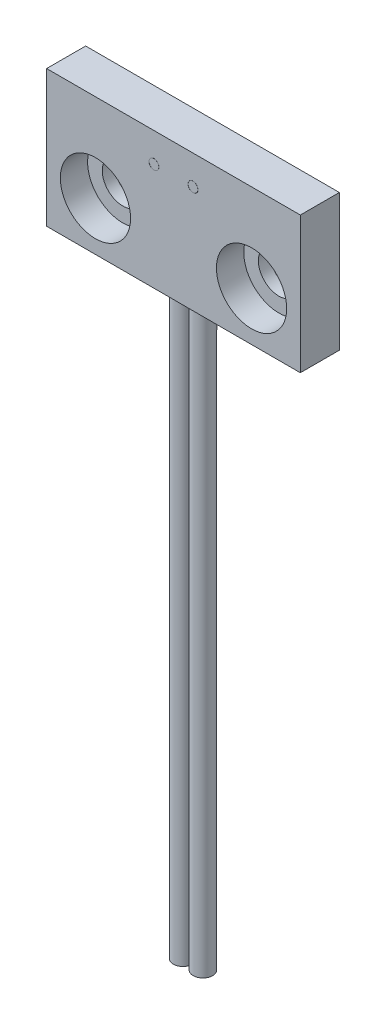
SolidWorks part; units mm, degrees
ref_plane "前视基准面" through (0, 0, 0) normal (0, 0, 1) x (1, 0, 0)
ref_plane "上视基准面" through (0, 0, 0) normal (0, 1, 0) x (1, 0, 0)
ref_plane "右视基准面" through (0, 0, 0) normal (1, 0, 0) x (0, 0, -1)
sketch "草图1" plane through (0, 0, 0) normal (0, 0, 1) x (1, 0, 0)
  line L1 (6.5, -3.5) -> (-6.5, -3.5)
  line L2 (6.5, -3.5) -> (6.5, 3.5)
  line L3 (6.5, 3.5) -> (-6.5, 3.5)
  line L4 (-6.5, -3.5) -> (-6.5, 3.5)
  line L5 (6.5, -3.5) -> (-6.5, 3.5) construction
  line L6 (6.5, 3.5) -> (-6.5, -3.5) construction
  point P0 (0, 0)
  dimension "D1" = 7
  dimension "D2" = 13
extrude "凸台-拉伸1" add sketch "草图1" along normal mid plane 2
hole_wizard "沉头孔1" positions "草图6" profile "草图7" counterbore size "M2" standard "GB"
sketch "草图6" plane through (0, 0, 1) normal (0, 0, 1) x (1, 0, 0)
  line L1 (6.5, 3.5) -> (-6.5, 3.5) construction
  point P0 (-4, -1)
  point P2 (4, -1)
  dimension "D1" = 8
  dimension "D2" = 4
  dimension "D3" = 4.5
sketch "草图7" plane through (-4, -1, 1) normal (1, 0, 0) x (0, -1, 0)
  line L0 (0, 0) -> (0, 2)
  line L1 (0, 2) -> (1.05, 2)
  line L3 (1.05, 2) -> (1.05, 1.4)
  line L4 (1.05, 1.4) -> (1.8, 1.4)
  line L5 (1.8, 1.4) -> (1.8, 0)
  line L7 (1.8, 0) -> (0, 0)
  line L11 (0, -6.35) -> (0, 107.95) construction
  dimension "通孔孔直径" = 2.1
  dimension "通孔孔深度" = 2
  dimension "柱形沉头孔直径" = 3.6
  dimension "柱形沉头孔深度" = 1.4
sketch "草图8" plane through (0, 0, 1) normal (0, 0, 1) x (1, 0, 0)
  line L0 (0, -1000) -> (0, 49000) construction
  line L1 (6.5, 3.5) -> (-6.5, 3.5) construction
  circle A0 centre (-1, 2) radius 0.25
  circle A1 centre (1, 2) radius 0.25
  circle A2 centre (-1, 2) radius 0.255
  circle A3 centre (1, 2) radius 0.255
  dimension "D1" = 0.5
  dimension "D4" = 0.51
  dimension "D5" = 0.51
  dimension "D2" = 2
  dimension "D3" = 1.5
sketch "草图9" plane through (0, -3.5, 0) normal (0, -1, 0) x (1, 0, 0)
  circle A2 centre (0.51, 0) radius 0.5
  circle A3 centre (-0.51, 0) radius 0.5
  point P4 (0, 0)
  dimension "D1" = 1
  dimension "D2" = 0.01
  dimension "D3" = 0.01
extrude "凸台-拉伸2" add sketch "草图9" along normal blind 30
extrude "切除-拉伸1" cut sketch "草图8" against normal blind 0.1
